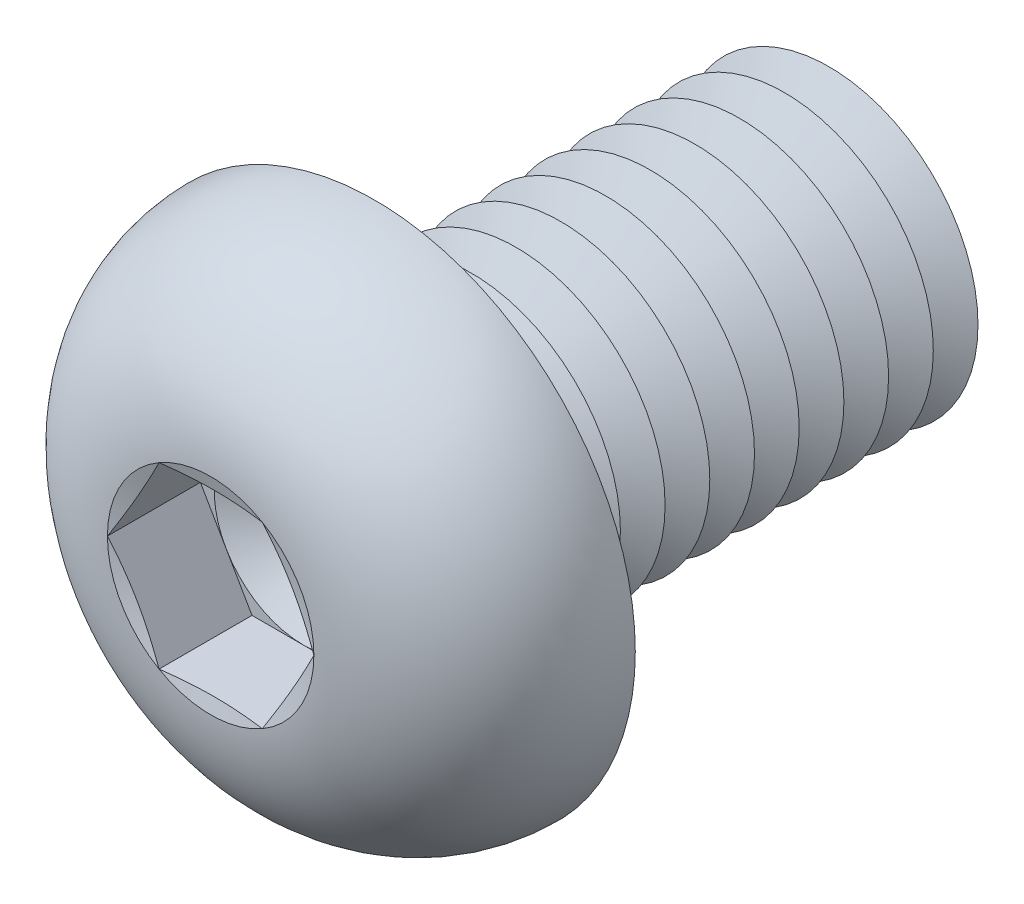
SolidWorks part; units mm, degrees
ref_plane "Front Plane" through (0, 0, 0) normal (0, 0, 1) x (1, 0, 0)
ref_plane "Top Plane" through (0, 0, 0) normal (0, 1, 0) x (1, 0, 0)
ref_plane "Right Plane" through (0, 0, 0) normal (1, 0, 0) x (0, 0, -1)
sketch "Sketch1" plane through (0, 0, 0) normal (1, 0, 0) x (0, 0, -1)
  line L0 (0, 5) -> (0, 8.75)
  line L3 (0, 5) -> (16, 5)
  line L4 (16, 5) -> (16, 0)
  line L5 (16, 0) -> (-5.5, 0) construction
  line L6 (-5.5, 0) -> (16, 0)
  line L7 (-5.5, 3.4641) -> (-5.5, 1.732) construction
  line L8 (-5.5, 1.732) -> (-5.5, 0)
  line L9 (-5.5, 3.4641) -> (-5.0359, 1.732)
  line L10 (-5.0359, 1.732) -> (-5.5, 1.732)
  line L11 (16, 0) -> (22.7481, 0) construction
  line L12 (0, 8.75) -> (-5.5, 8.75) construction
  arc A1 (0, 8.75) -> (-5.5, 3.4641) centre (0, 3.2457) ccw
  point P8 (16, 2.5)
  dimension "D1" = 17.5
  dimension "D2" = 10
  dimension "D3" = 5.5
  dimension "D4" = 6.9282
  dimension "D5" = 16
  dimension "D6" = 15
revolve "Revolve1" add sketch "Sketch1" angle 360 about L5
fillet "Fillet1" radius 0.75 1 edges at (-5, 0, 0)
sketch "Sketch2" plane through (0, 0, 0) normal (1, 0, 0) x (0, 0, -1)
  line L0 (15.25, 5) -> (16.75, 5)
  line L1 (16, 5) -> (0.75, 5) construction
  line L2 (16.75, 5) -> (16, 3.701)
  line L3 (16, -5) -> (16, 5) construction
  line L4 (16, 3.701) -> (15.25, 5)
  dimension "D1" = 1.5
revolve "Cut-Revolve1" cut sketch "Sketch2" angle 360 about axis through (0, 0, -16) along (0, 0, -1)
pattern_linear "LPattern1" count 10 spacing 1.5 along (0, 0, 1) of "Cut-Revolve1"
sketch "Sketch3" plane through (0, 0, 5.5) normal (0, 0, 1) x (1, 0, 0)
  line L7 (1.732, 3) -> (-1.7321, 3)
  line L8 (-1.7321, 3) -> (-3.4641, 0)
  line L9 (-3.4641, 0) -> (-1.732, -3)
  line L10 (-1.732, -3) -> (1.732, -3)
  line L11 (1.732, -3) -> (3.4641, 0)
  line L12 (3.4641, 0) -> (1.732, 3)
  circle A0 centre (0, 0) radius 3 construction
  circle A3 centre (0, 0) radius 3.4641 construction
extrude "Cut-Extrude1" cut sketch "Sketch3" against normal blind 3.12
sketch "Sketch4" plane through (0, 0, 2.38) normal (0, 0, 1) x (1, 0, 0)
  line L1 (1.732, 3) -> (-1.7321, 3) construction
  circle A0 centre (0, 0) radius 3
extrude "Cut-Extrude2" cut sketch "Sketch4" against normal through all draft 60
